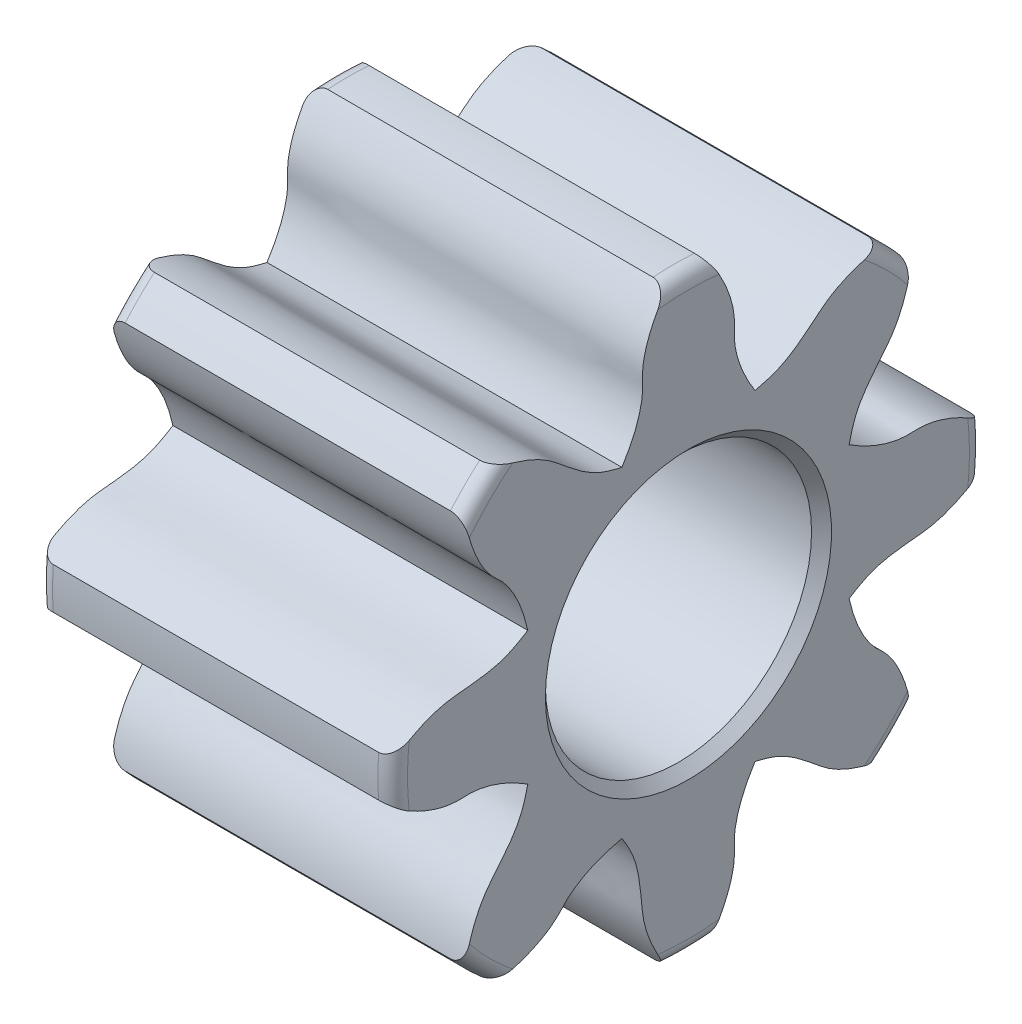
SolidWorks part; units mm, degrees
ref_plane "Front Plane" through (0, 0, 0) normal (0, 0, 1) x (1, 0, 0)
ref_plane "Top Plane" through (0, 0, 0) normal (0, 1, 0) x (1, 0, 0)
ref_plane "Right Plane" through (0, 0, 0) normal (1, 0, 0) x (0, 0, -1)
ref_plane "Plane1" through (-1.5875, 0, 0) normal (-1, 0, 0) x (0, -1, 0)
sketch "Sketch1" plane through (-1.5875, 0, 0) normal (-1, 0, 0) x (0, -1, 0)
  arc A0 (-1.9972, -1.7354) -> (-2.6393, -0.1851) centre (0, 0) ccw
  spline S0 degree 3 poles (-1.9972, -1.7354) (-1.9878, -1.6807) (-1.9756, -1.6264) (-1.9605, -1.5731) (-1.9225, -1.4396) (-1.8657, -1.3068) (-1.7792, -1.1982) (-1.668, -1.0587) (-1.5388, -0.9223) (-1.4813, -0.7534) (-1.4636, -0.7017) (-1.4491, -0.6488) (-1.4373, -0.5954) knots -0.000165 -0.000165 -0.000165 -0.000165 0 0 0 0.000416 0.000416 0.000416 0.00094 0.00094 0.00094 0.001096 0.001096 0.001096 0.001096
  spline S1 degree 3 poles (-1.4373, -0.5954) (-1.5487, -0.5241) (-1.6705, -0.4643) (-1.7987, -0.4319) (-1.8627, -0.4158) (-1.9297, -0.406) (-1.9956, -0.4101) (-2.0615, -0.4143) (-2.1287, -0.4099) (-2.1932, -0.3955) (-2.3001, -0.3716) (-2.4028, -0.3272) (-2.4986, -0.2739) (-2.547, -0.2469) (-2.594, -0.2171) (-2.6393, -0.1851) knots 0 0 0 0 0.000397 0.000397 0.000397 0.000593 0.000593 0.000593 0.000789 0.000789 0.000789 0.001115 0.001115 0.001115 0.001279 0.001279 0.001279 0.001279
extrude "Boss-Extrude1" add sketch "Sketch1" against normal blind 3.175
sketch "Sketch2" plane through (1.5875, 0, 0) normal (1, 0, 0) x (0, 0, -1)
  arc A0 (2.6393, 0.1851) -> (1.9972, 1.7354) centre (0, 0) ccw
  spline S0 degree 3 poles (1.9972, 1.7354) (1.9878, 1.6807) (1.9756, 1.6264) (1.9605, 1.5731) (1.9225, 1.4396) (1.8657, 1.3068) (1.7792, 1.1982) (1.668, 1.0587) (1.5388, 0.9223) (1.4813, 0.7534) (1.4636, 0.7017) (1.4491, 0.6488) (1.4373, 0.5954) knots -0.000165 -0.000165 -0.000165 -0.000165 0 0 0 0.000416 0.000416 0.000416 0.00094 0.00094 0.00094 0.001096 0.001096 0.001096 0.001096
  spline S1 degree 3 poles (1.4373, 0.5954) (1.5487, 0.5241) (1.6705, 0.4643) (1.7987, 0.4319) (1.8627, 0.4158) (1.9297, 0.406) (1.9956, 0.4101) (2.0615, 0.4143) (2.1287, 0.4099) (2.1932, 0.3955) (2.3001, 0.3716) (2.4028, 0.3272) (2.4986, 0.2739) (2.547, 0.2469) (2.594, 0.2171) (2.6393, 0.1851) knots 0 0 0 0 0.000397 0.000397 0.000397 0.000593 0.000593 0.000593 0.000789 0.000789 0.000789 0.001115 0.001115 0.001115 0.001279 0.001279 0.001279 0.001279
extrude "Cut-Extrude1" cut sketch "Sketch2" against normal through all
sketch "Sketch3" plane through (1.5875, 0, 0) normal (1, 0, 0) x (0, 0, -1)
  arc A0 (1.9972, -1.7354) -> (2.6393, -0.1851) centre (0, 0) ccw
  spline S0 degree 3 poles (2.6393, -0.1851) (2.594, -0.2171) (2.547, -0.2469) (2.4986, -0.2739) (2.3773, -0.3414) (2.2433, -0.3952) (2.1054, -0.4108) (1.928, -0.4309) (1.7403, -0.4359) (1.5802, -0.5147) (1.5311, -0.5388) (1.4834, -0.5659) (1.4373, -0.5954) knots -0.000165 -0.000165 -0.000165 -0.000165 0 0 0 0.000416 0.000416 0.000416 0.00094 0.00094 0.00094 0.001096 0.001096 0.001096 0.001096
  spline S1 degree 3 poles (1.4373, -0.5954) (1.4657, -0.7245) (1.5095, -0.8529) (1.5773, -0.9665) (1.6111, -1.0232) (1.6516, -1.0774) (1.7011, -1.1211) (1.7506, -1.1648) (1.795, -1.2154) (1.8304, -1.2711) (1.8892, -1.3636) (1.9305, -1.4677) (1.9605, -1.5731) (1.9756, -1.6264) (1.9878, -1.6807) (1.9972, -1.7354) knots 0 0 0 0 0.000397 0.000397 0.000397 0.000593 0.000593 0.000593 0.000789 0.000789 0.000789 0.001115 0.001115 0.001115 0.001279 0.001279 0.001279 0.001279
extrude "Cut-Extrude2" cut sketch "Sketch3" against normal through all
sketch "Sketch4" plane through (1.5875, 0, 0) normal (1, 0, 0) x (0, 0, -1)
  arc A0 (0.1851, -2.6393) -> (1.7354, -1.9972) centre (0, 0) ccw
  spline S0 degree 3 poles (1.7354, -1.9972) (1.6807, -1.9878) (1.6264, -1.9756) (1.5731, -1.9605) (1.4396, -1.9225) (1.3068, -1.8657) (1.1982, -1.7792) (1.0587, -1.668) (0.9223, -1.5388) (0.7534, -1.4813) (0.7017, -1.4636) (0.6488, -1.4491) (0.5954, -1.4373) knots -0.000165 -0.000165 -0.000165 -0.000165 0 0 0 0.000416 0.000416 0.000416 0.00094 0.00094 0.00094 0.001096 0.001096 0.001096 0.001096
  spline S1 degree 3 poles (0.5954, -1.4373) (0.5241, -1.5487) (0.4643, -1.6705) (0.4319, -1.7987) (0.4158, -1.8627) (0.406, -1.9297) (0.4101, -1.9956) (0.4143, -2.0615) (0.4099, -2.1287) (0.3955, -2.1932) (0.3716, -2.3001) (0.3272, -2.4028) (0.2739, -2.4986) (0.2469, -2.547) (0.2171, -2.594) (0.1851, -2.6393) knots 0 0 0 0 0.000397 0.000397 0.000397 0.000593 0.000593 0.000593 0.000789 0.000789 0.000789 0.001115 0.001115 0.001115 0.001279 0.001279 0.001279 0.001279
extrude "Cut-Extrude3" cut sketch "Sketch4" against normal through all
sketch "Sketch5" plane through (1.5875, 0, 0) normal (1, 0, 0) x (0, 0, -1)
  arc A0 (-1.7354, -1.9972) -> (-0.1851, -2.6393) centre (0, 0) ccw
  spline S0 degree 3 poles (-0.1851, -2.6393) (-0.2171, -2.594) (-0.2469, -2.547) (-0.2739, -2.4986) (-0.3414, -2.3773) (-0.3952, -2.2433) (-0.4108, -2.1054) (-0.4309, -1.928) (-0.4359, -1.7403) (-0.5147, -1.5802) (-0.5388, -1.5311) (-0.5659, -1.4834) (-0.5954, -1.4373) knots -0.000165 -0.000165 -0.000165 -0.000165 0 0 0 0.000416 0.000416 0.000416 0.00094 0.00094 0.00094 0.001096 0.001096 0.001096 0.001096
  spline S1 degree 3 poles (-0.5954, -1.4373) (-0.7245, -1.4657) (-0.8529, -1.5095) (-0.9665, -1.5773) (-1.0232, -1.6111) (-1.0774, -1.6516) (-1.1211, -1.7011) (-1.1648, -1.7506) (-1.2154, -1.795) (-1.2711, -1.8304) (-1.3636, -1.8892) (-1.4677, -1.9305) (-1.5731, -1.9605) (-1.6264, -1.9756) (-1.6807, -1.9878) (-1.7354, -1.9972) knots 0 0 0 0 0.000397 0.000397 0.000397 0.000593 0.000593 0.000593 0.000789 0.000789 0.000789 0.001115 0.001115 0.001115 0.001279 0.001279 0.001279 0.001279
extrude "Cut-Extrude4" cut sketch "Sketch5" against normal through all
sketch "Sketch6" plane through (1.5875, 0, 0) normal (1, 0, 0) x (0, 0, -1)
  arc A0 (-2.6393, -0.1851) -> (-1.9972, -1.7354) centre (0, 0) ccw
  spline S0 degree 3 poles (-1.9972, -1.7354) (-1.9878, -1.6807) (-1.9756, -1.6264) (-1.9605, -1.5731) (-1.9225, -1.4396) (-1.8657, -1.3068) (-1.7792, -1.1982) (-1.668, -1.0587) (-1.5388, -0.9223) (-1.4813, -0.7534) (-1.4636, -0.7017) (-1.4491, -0.6488) (-1.4373, -0.5954) knots -0.000165 -0.000165 -0.000165 -0.000165 0 0 0 0.000416 0.000416 0.000416 0.00094 0.00094 0.00094 0.001096 0.001096 0.001096 0.001096
  spline S1 degree 3 poles (-1.4373, -0.5954) (-1.5487, -0.5241) (-1.6705, -0.4643) (-1.7987, -0.4319) (-1.8627, -0.4158) (-1.9297, -0.406) (-1.9956, -0.4101) (-2.0615, -0.4143) (-2.1287, -0.4099) (-2.1932, -0.3955) (-2.3001, -0.3716) (-2.4028, -0.3272) (-2.4986, -0.2739) (-2.547, -0.2469) (-2.594, -0.2171) (-2.6393, -0.1851) knots 0 0 0 0 0.000397 0.000397 0.000397 0.000593 0.000593 0.000593 0.000789 0.000789 0.000789 0.001115 0.001115 0.001115 0.001279 0.001279 0.001279 0.001279
extrude "Cut-Extrude5" cut sketch "Sketch6" against normal through all
sketch "Sketch7" plane through (1.5875, 0, 0) normal (1, 0, 0) x (0, 0, -1)
  arc A0 (-1.9972, 1.7354) -> (-2.6393, 0.1851) centre (0, 0) ccw
  spline S0 degree 3 poles (-2.6393, 0.1851) (-2.594, 0.2171) (-2.547, 0.2469) (-2.4986, 0.2739) (-2.3773, 0.3414) (-2.2433, 0.3952) (-2.1054, 0.4108) (-1.928, 0.4309) (-1.7403, 0.4359) (-1.5802, 0.5147) (-1.5311, 0.5388) (-1.4834, 0.5659) (-1.4373, 0.5954) knots -0.000165 -0.000165 -0.000165 -0.000165 0 0 0 0.000416 0.000416 0.000416 0.00094 0.00094 0.00094 0.001096 0.001096 0.001096 0.001096
  spline S1 degree 3 poles (-1.4373, 0.5954) (-1.4657, 0.7245) (-1.5095, 0.8529) (-1.5773, 0.9665) (-1.6111, 1.0232) (-1.6516, 1.0774) (-1.7011, 1.1211) (-1.7506, 1.1648) (-1.795, 1.2154) (-1.8304, 1.2711) (-1.8892, 1.3636) (-1.9305, 1.4677) (-1.9605, 1.5731) (-1.9756, 1.6264) (-1.9878, 1.6807) (-1.9972, 1.7354) knots 0 0 0 0 0.000397 0.000397 0.000397 0.000593 0.000593 0.000593 0.000789 0.000789 0.000789 0.001115 0.001115 0.001115 0.001279 0.001279 0.001279 0.001279
extrude "Cut-Extrude6" cut sketch "Sketch7" against normal through all
sketch "Sketch8" plane through (1.5875, 0, 0) normal (1, 0, 0) x (0, 0, -1)
  arc A0 (-0.1851, 2.6393) -> (-1.7354, 1.9972) centre (0, 0) ccw
  spline S0 degree 3 poles (-1.7354, 1.9972) (-1.6807, 1.9878) (-1.6264, 1.9756) (-1.5731, 1.9605) (-1.4396, 1.9225) (-1.3068, 1.8657) (-1.1982, 1.7792) (-1.0587, 1.668) (-0.9223, 1.5388) (-0.7534, 1.4813) (-0.7017, 1.4636) (-0.6488, 1.4491) (-0.5954, 1.4373) knots -0.000165 -0.000165 -0.000165 -0.000165 0 0 0 0.000416 0.000416 0.000416 0.00094 0.00094 0.00094 0.001096 0.001096 0.001096 0.001096
  spline S1 degree 3 poles (-0.5954, 1.4373) (-0.5241, 1.5487) (-0.4643, 1.6705) (-0.4319, 1.7987) (-0.4158, 1.8627) (-0.406, 1.9297) (-0.4101, 1.9956) (-0.4143, 2.0615) (-0.4099, 2.1287) (-0.3955, 2.1932) (-0.3716, 2.3001) (-0.3272, 2.4028) (-0.2739, 2.4986) (-0.2469, 2.547) (-0.2171, 2.594) (-0.1851, 2.6393) knots 0 0 0 0 0.000397 0.000397 0.000397 0.000593 0.000593 0.000593 0.000789 0.000789 0.000789 0.001115 0.001115 0.001115 0.001279 0.001279 0.001279 0.001279
extrude "Cut-Extrude7" cut sketch "Sketch8" against normal through all
hole_wizard "Hole1" positions "Sketch10" profile "Sketch9" legacy
sketch "Sketch10" plane through (-1.5875, 0, 0) normal (-1, 0, 0) x (0, 0, 1)
  point P0 (0, 0)
sketch "Sketch9" plane through (-1.5875, 0, 0) normal (0, 1, 0) x (0, 0, 1)
  line L0 (0, 0) -> (0, 3.175)
  line L1 (0, 3.175) -> (1.1906, 3.175)
  line L2 (1.1906, 3.175) -> (1.1906, 0)
  line L3 (1.1906, 0) -> (0, 0)
  line L4 (0, 110) -> (0, -10) construction
  dimension "Diameter" = 2.3812
  dimension "Depth" = 3.175
chamfer "Chamfer1" distance 0.0893 angle 45 1 edges at (-1.5875, 0, 1.1906)
chamfer "Chamfer2" distance 0.0893 angle 45 1 edges at (1.5875, 0, 1.1906)
fillet "Fillet1" radius 0.1323 1 edges at (-1.5875, 0, -2.6458)
fillet "Fillet2" radius 0.1323 1 edges at (-1.5875, 1.8709, -1.8709)
fillet "Fillet3" radius 0.1323 1 edges at (-1.5875, -1.8709, -1.8709)
fillet "Fillet4" radius 0.1323 1 edges at (1.5875, 1.8709, -1.8709)
fillet "Fillet5" radius 0.1323 1 edges at (-1.5875, -2.6458, 0)
fillet "Fillet6" radius 0.1323 1 edges at (1.5875, -1.8709, -1.8709)
fillet "Fillet7" radius 0.1323 1 edges at (-1.5875, -1.8709, 1.8709)
fillet "Fillet8" radius 0.1323 1 edges at (1.5875, -1.8709, 1.8709)
fillet "Fillet9" radius 0.1323 1 edges at (-1.5875, 0, 2.6458)
fillet "Fillet10" radius 0.1323 1 edges at (1.5875, 1.8709, 1.8709)
fillet "Fillet11" radius 0.1323 1 edges at (-1.5875, 1.8709, 1.8709)
fillet "Fillet12" radius 0.1323 1 edges at (1.5875, 0, -2.6458)
fillet "Fillet13" radius 0.1323 1 edges at (-1.5875, 2.6458, 0)
fillet "Fillet14" radius 0.1323 1 edges at (1.5875, 0, 2.6458)
fillet "Fillet15" radius 0.1323 1 edges at (1.5875, -2.6458, 0)
fillet "Fillet16" radius 0.1323 1 edges at (1.5875, 2.6458, 0)
